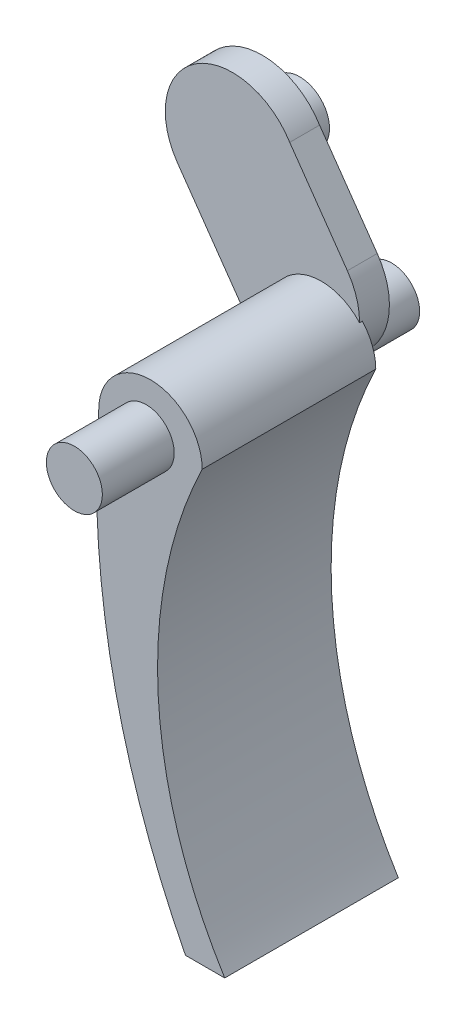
SolidWorks part; units mm, degrees
ref_plane "Спереди" through (0, 0, 0) normal (0, 0, 1) x (1, 0, 0)
ref_plane "Сверху" through (0, 0, 0) normal (0, 1, 0) x (1, 0, 0)
ref_plane "Справа" through (0, 0, 0) normal (1, 0, 0) x (0, 0, -1)
sketch "Эскиз1" plane through (0, 0, 0) normal (0, 0, 1) x (1, 0, 0)
  line L0 (0, -1000) -> (0, 49000) construction
  line L1 (-1000, 0) -> (49000, 0) construction
  circle A0 centre (0, 0) radius 1.5
extrude "Бобышка-Вытянуть_ось" add sketch "Эскиз1" along normal mid plane 17
sketch "Эскиз2" plane through (0, 0, 0) normal (0, 0, 1) x (1, 0, 0)
  line L0 (0, 0) -> (0, -23) construction
  line L1 (-999.5302, -23) -> (49000.4698, -23) construction
  line L2 (0, 0) -> (3, 0) construction
  line L3 (0, 0) -> (-2.5433, 0) construction
  line L4 (-2.5433, -1000) -> (-2.5433, 49000) construction
  line L6 (0, -23) -> (4.2067, -23) construction
  line L8 (2.1034, -23) -> (4.2067, -23)
  arc A0 (4.2067, -23) -> (3, 0) centre (24.4427, -10.4066) cw
  arc A1 (2.1034, -23) -> (-2.5433, 0) centre (40.64, -3.2451) cw
  arc A2 (-2.5433, 0) -> (3, 0) centre (0.2284, 0) cw
  point P9 (2.9738, 0)
  point P13 (0, 0)
  point P16 (0, 0)
  point P17 (0, 4.1758)
  point P18 (0, 4.1758)
  point P19 (0, 4.1758)
  point P20 (0, 0)
  point P21 (3.2433, 0)
extrude "Бобышка-Вытянуть_спуск" add sketch "Эскиз2" along normal mid plane 9.3 separate body
ref_plane "Плоскость1" through (0, 0, 0) normal (0, 0, -1) x (-1, 0, 0)
ref_plane "Плоскость2" through (0, 0, -4.5) normal (0, 0, -1) x (-1, 0, 0)
sketch "Эскиз3" plane through (0, 0, -4.5) normal (0, 0, -1) x (-1, 0, 0)
  line L0 (0, 0) -> (28643.5143, 40907.1778) construction
  line L1 (-1.6288, 3.9529) -> (1.4604, 8.3648)
  line L2 (4.3883, -0.0011) -> (7.4775, 4.4107)
  line L3 (-1.6288, 3.9529) -> (1.3214, 1.8872) construction
  arc A0 (1.4604, 8.3648) -> (7.4775, 4.4107) centre (4.5272, 6.4765) cw
  arc A1 (-1.6288, 3.9529) -> (4.3883, -0.0011) centre (1.3214, 1.8872) ccw
  point P9 (6.5051, 9.4863)
  point P10 (0, 0)
  point P13 (-0.6565, -1.1227)
  dimension "D1" = 7.2
  dimension "D2" = 12.8
extrude "Бобышка-Вытянуть2" add sketch "Эскиз3" along normal blind 1.6
sketch "Эскиз4" plane through (0, 0, -6.1) normal (0, 0, -1) x (-1, 0, 0)
  circle A0 centre (4.5272, 6.4765) radius 1.6
extrude "Бобышка-Вытянуть3" add sketch "Эскиз4" along normal blind 2
